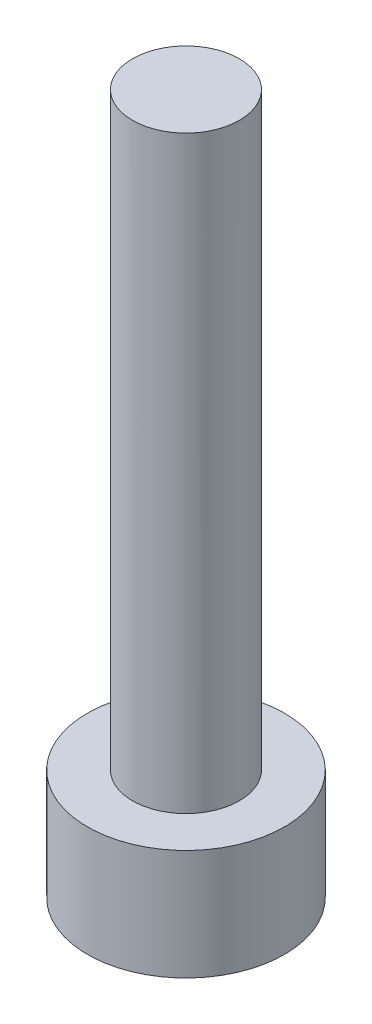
SolidWorks part; units mm, degrees
ref_plane "Front Plane" through (0, 0, 0) normal (0, 0, 1) x (1, 0, 0)
ref_plane "Top Plane" through (0, 0, 0) normal (0, 1, 0) x (1, 0, 0)
ref_plane "Right Plane" through (0, 0, 0) normal (1, 0, 0) x (0, 0, -1)
sketch "Sketch1" plane through (0, 0, 0) normal (0, 1, 0) x (1, 0, 0)
  circle A0 centre (0, 0) radius 1.45
extrude "Boss-Extrude1" add sketch "Sketch1" along normal blind 16
sketch "Sketch2" plane through (0, 0, 0) normal (0, -1, 0) x (1, 0, 0)
  circle A0 centre (0, 0) radius 2.675
extrude "Boss-Extrude2" add sketch "Sketch2" along normal blind 3
sketch "Sketch3" plane through (0, -3, 0) normal (0, -1, 0) x (1, 0, 0)
  line L1 (1.6619, 0.4878) -> (0.4085, 1.6832)
  line L2 (0.4085, 1.6832) -> (-1.2534, 1.1954)
  line L3 (-1.2534, 1.1954) -> (-1.6619, -0.4878)
  line L4 (-1.6619, -0.4878) -> (-0.4085, -1.6832)
  line L5 (-0.4085, -1.6832) -> (1.2534, -1.1954)
  line L6 (1.2534, -1.1954) -> (1.6619, 0.4878)
  circle A0 centre (0, 0) radius 1.5 construction
extrude "Cut-Extrude1" cut sketch "Sketch3" against normal blind 2
